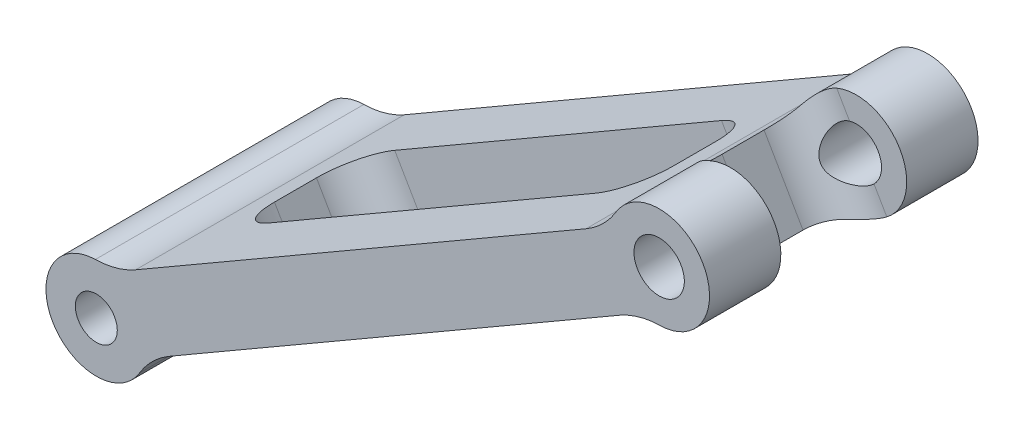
SolidWorks part; units mm, degrees
ref_plane "Face" through (0, 0, 0) normal (0, 0, 1) x (1, 0, 0)
ref_plane "Dessus" through (0, 0, 0) normal (0, 1, 0) x (1, 0, 0)
ref_plane "Droite" through (0, 0, 0) normal (1, 0, 0) x (0, 0, -1)
imported_body "Importée1"
sketch "Esquisse1" plane through (0, 0, 16) normal (0, 0, 1) x (1, 0, 0)
  circle A0 centre (-126.1789, 217.393) radius 5.0472
  circle A1 centre (-126.1789, 217.393) radius 3 construction
extrude "Extrusion1" add sketch "Esquisse1" against normal through all
hole_wizard "Trou taraudé M6x1.01" positions "Esquisse5" profile "Esquisse4" tap size "M6x1.0" standard "ISO"
sketch "Esquisse5" plane through (0, 0, 16) normal (0, 0, 1) x (1, 0, 0)
  arc A0 (-126.2954, 223.3919) -> (-121.0346, 214.3049) centre (-126.1789, 217.393) ccw construction
  point P0 (-126.1789, 217.393)
sketch "Esquisse4" plane through (-126.1789, 217.393, 16) normal (1, 0, 0) x (0, -1, 0)
  line L0 (0, 0) -> (0, 32)
  line L1 (0, 32) -> (2.5, 32)
  line L2 (2.5, 32) -> (2.5, 0)
  line L5 (2.5, 0) -> (0, 0)
  line L11 (0, -6.35) -> (0, 107.95) construction
  dimension "Diamètre du trou pour taraudage jusqu'au prochain" = 5
  dimension "Profondeur du trou pour taraudage jusqu'au prochain" = 32
